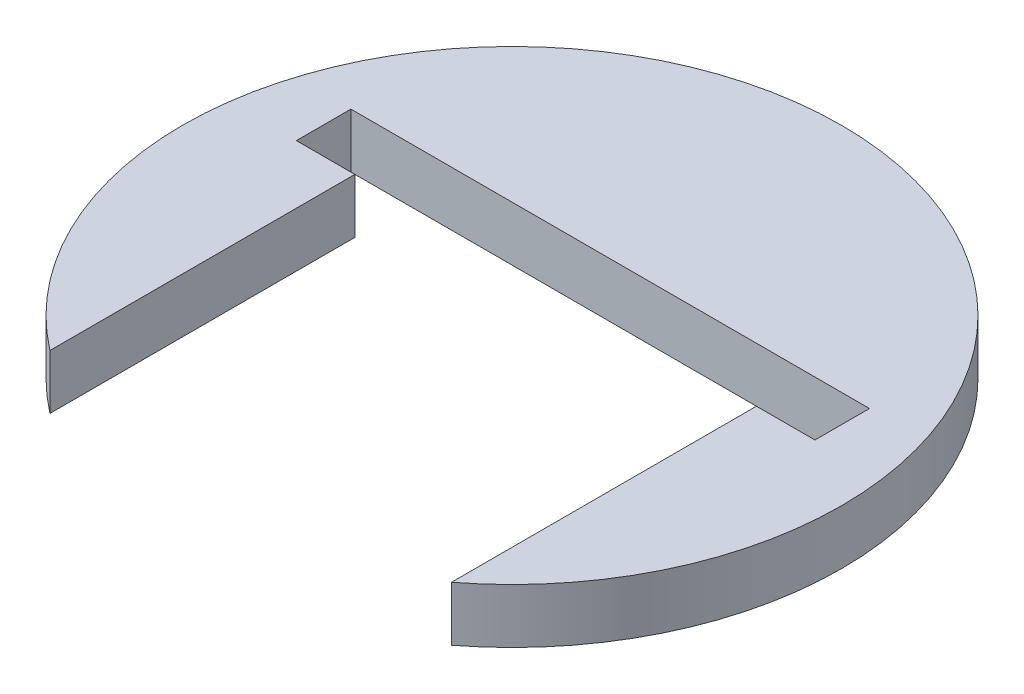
SolidWorks part; units mm, degrees
ref_plane "Front Plane" through (0, 0, 0) normal (0, 0, 1) x (1, 0, 0)
ref_plane "Top Plane" through (0, 0, 0) normal (0, 1, 0) x (1, 0, 0)
ref_plane "Right Plane" through (0, 0, 0) normal (1, 0, 0) x (0, 0, -1)
sketch "Sketch1" plane through (0, 0, 0) normal (0, 1, 0) x (1, 0, 0)
  circle A0 centre (0, 0) radius 19.177
extrude "Boss-Extrude1" add sketch "Sketch1" along normal blind 3.175
sketch "Sketch2" plane through (0, 3.175, 0) normal (0, 1, 0) x (1, 0, 0)
  line L0 (0, 19.177) -> (0, -19.177) construction
  line L2 (-15.0899, 2.54) -> (15.0899, 2.54)
  line L3 (-15.0899, 2.54) -> (-15.0899, 5.715)
  line L4 (-15.0899, 5.715) -> (15.0899, 5.715)
  line L5 (15.0899, 2.54) -> (15.0899, 5.715)
  line L6 (-15.0899, 2.54) -> (15.0899, 5.715) construction
  line L7 (-15.0899, 5.715) -> (15.0899, 2.54) construction
  circle A0 centre (0, 0) radius 19.177 construction
  point P5 (0, 4.1275)
extrude "Cut-Extrude1" cut sketch "Sketch2" against normal through all
sketch "Sketch3" plane through (0, 3.175, 0) normal (0, 1, 0) x (1, 0, 0)
  line L0 (0, 19.177) -> (0, -19.177) construction
  line L1 (-15.0899, 2.54) -> (15.0899, 2.54) construction
  line L2 (-11.684, -22.86) -> (11.684, -22.86)
  line L3 (-11.684, -22.86) -> (-11.684, 2.54)
  line L4 (-11.684, 2.54) -> (11.684, 2.54)
  line L5 (11.684, -22.86) -> (11.684, 2.54)
  line L6 (-11.684, -22.86) -> (11.684, 2.54) construction
  line L7 (-11.684, 2.54) -> (11.684, -22.86) construction
  circle A0 centre (0, 0) radius 19.177 construction
  point P5 (0, -10.16)
  dimension "D1" = 23.368
  dimension "D2" = 25.4
extrude "Cut-Extrude2" cut sketch "Sketch3" against normal through all
sketch "Sketch4" plane through (0, 3.175, 0) normal (0, 1, 0) x (1, 0, 0)
  line L14 (11.43, 2.794) -> (11.43, -15.7137)
  line L15 (-11.43, -15.7137) -> (-11.43, 2.794)
  line L16 (-11.43, 2.794) -> (-14.8359, 2.794)
  line L17 (-14.8359, 2.794) -> (-14.8359, 5.461)
  line L18 (-14.8359, 5.461) -> (14.8359, 5.461)
  line L19 (14.8359, 5.461) -> (14.8359, 2.794)
  line L20 (14.8359, 2.794) -> (11.43, 2.794)
  line L21 (11.43, 2.794) -> (11.43, -15.7137)
  line L22 (-11.43, -15.7137) -> (-11.43, 2.794)
  line L23 (-11.43, 2.794) -> (-14.8359, 2.794)
  line L24 (-14.8359, 2.794) -> (-14.8359, 5.461)
  line L25 (-14.8359, 5.461) -> (14.8359, 5.461)
  line L26 (14.8359, 5.461) -> (14.8359, 2.794)
  line L27 (14.8359, 2.794) -> (11.43, 2.794)
  arc A2 (11.43, -15.7137) -> (-11.43, -15.7137) centre (0, 0) ccw
  arc A3 (11.43, -15.7137) -> (-11.43, -15.7137) centre (0, 0) ccw
  dimension "D1" = 0.254
equation "\"t\"= .125in"
equation "\"Db\"= 1.40in"
equation "\"dc\"= .1in"
equation "\"ce\"= .04in"
equation "\"BaseDiameter@Sketch1\" = \"Dm\""
equation "\"DistFromCenter@Sketch2\" = \"dc\""
equation "\"D1@Boss-Extrude1\"= \"t\""
equation "\"Thickness@Sketch2\"= \"t\""
equation "\"UprightWidth@Sketch2\"= 2 * sqr ( ( \"Db\" / 2 - \"ce\" ) ^ 2 - ( \"dc\" + 1.5 * \"t\" ) ^ 2 )"
equation "\"Dm\"= 1.51in"
